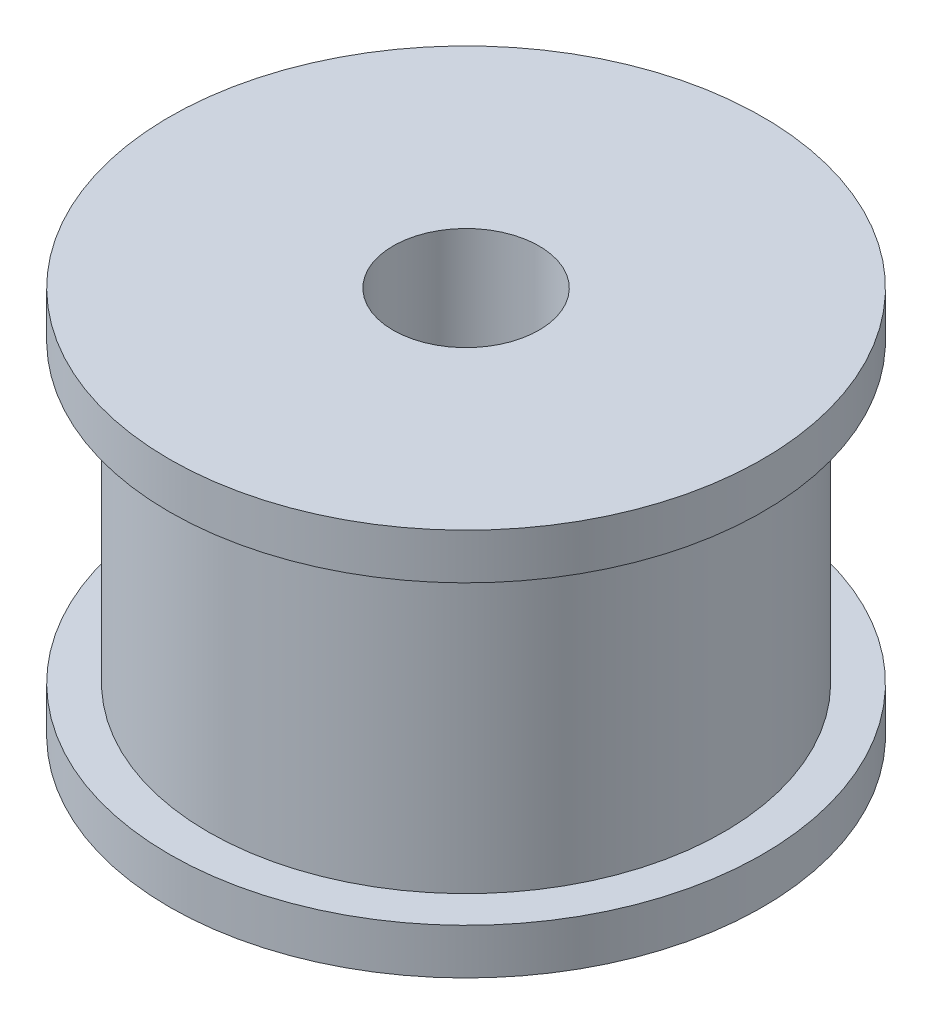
SolidWorks part; units mm, degrees
ref_plane "Спереди" through (0, 0, 0) normal (0, 0, 1) x (1, 0, 0)
ref_plane "Сверху" through (0, 0, 0) normal (0, 1, 0) x (1, 0, 0)
ref_plane "Справа" through (0, 0, 0) normal (1, 0, 0) x (0, 0, -1)
sketch "Эскиз1" plane through (0, 0, 0) normal (0, 0, 1) x (1, 0, 0)
  line L0 (0, -5.1123) -> (0, 5.1123) construction
  line L1 (0, 0) -> (-9.2527, 0) construction
  line L3 (-5.65, -3.25) -> (-5.65, 3.25)
  line L4 (-5.65, 3.25) -> (-6.5, 3.25)
  line L5 (-6.5, 3.25) -> (-6.5, 4.25)
  line L6 (-6.5, 4.25) -> (0, 4.25)
  line L7 (0, 4.25) -> (0, -4.25)
  line L11 (-6.5, -4.25) -> (0, -4.25)
  line L12 (-6.5, -3.25) -> (-6.5, -4.25)
  line L13 (-5.65, -3.25) -> (-6.5, -3.25)
  point P14 (-5.65, 0)
  dimension "D1" = 6.5
  dimension "D2" = 1
  dimension "D3" = 8.5
  dimension "D4" = 5.65
ref_axis "Ось1" through (0, 50, 0) along (0, -1, 0)
revolve "Повернуть3" add sketch "Эскиз1" angle 360 about axis through (0, 50, 0) along (0, -1, 0)
sketch "Эскиз2" plane through (0, 4.25, 0) normal (0, 1, 0) x (1, 0, 0)
  circle A0 centre (0, 0) radius 1.6
  dimension "D1" = 3.2
extrude "Вырез-Вытянуть1" cut sketch "Эскиз2" against normal blind 10
